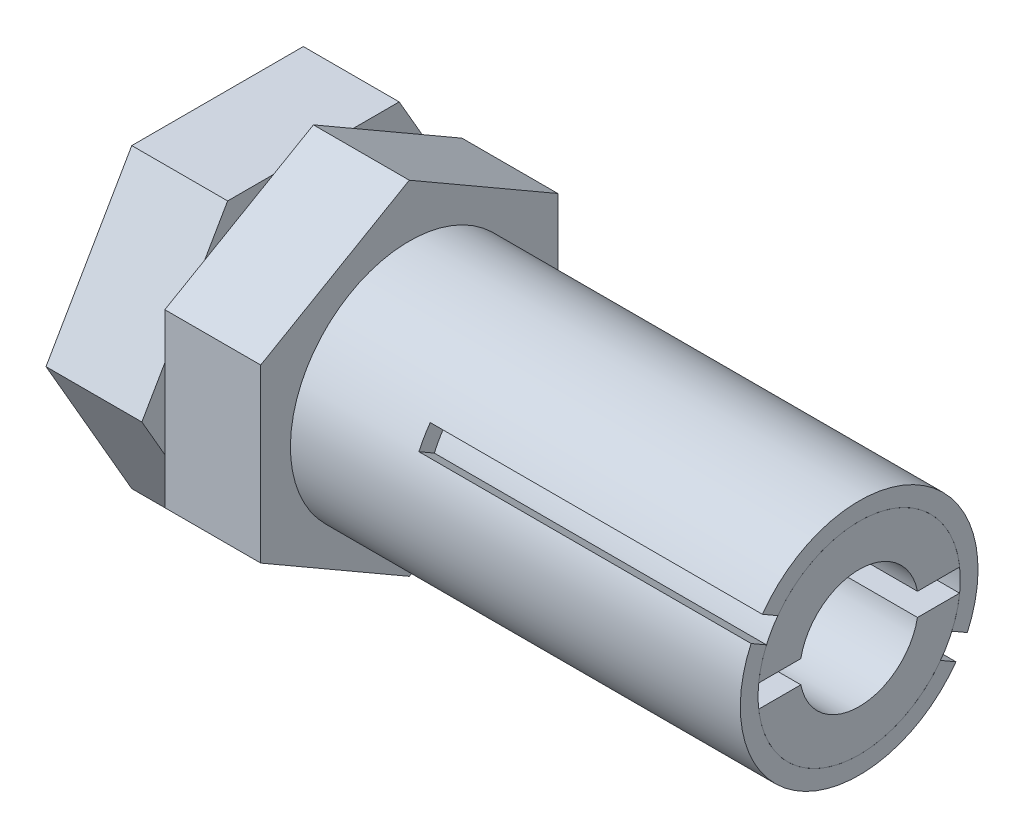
SolidWorks part; units mm, degrees
ref_plane "Front Plane" through (0, 0, 0) normal (0, 0, 1) x (1, 0, 0)
ref_plane "Top Plane" through (0, 0, 0) normal (0, 1, 0) x (1, 0, 0)
ref_plane "Right Plane" through (0, 0, 0) normal (1, 0, 0) x (0, 0, -1)
sketch "Sketch2" plane through (0, 0, 0) normal (1, 0, 0) x (0, 0, -1)
  line L1 (5.772, 0) -> (2.886, 4.9987)
  line L2 (2.886, 4.9987) -> (-2.886, 4.9987)
  line L3 (-2.886, 4.9987) -> (-5.772, 0)
  line L4 (-5.772, 0) -> (-2.886, -4.9987)
  line L5 (-2.886, -4.9987) -> (2.886, -4.9987)
  line L6 (2.886, -4.9987) -> (5.772, 0)
  circle A0 centre (0, 0) radius 4.9987 construction
  circle A1 centre (0, 0) radius 1.999
  dimension "D1" = 3.998
  dimension "D2" = 9.9974
extrude "Extrude1" add sketch "Sketch2" along normal blind 3.2258
sketch "Sketch3" plane through (3.2258, 0, 0) normal (1, 0, 0) x (0, 0, -1)
  line L1 (4.9987, 2.886) -> (0, 5.772)
  line L2 (0, 5.772) -> (-4.9987, 2.886)
  line L3 (-4.9987, 2.886) -> (-4.9987, -2.886)
  line L4 (-4.9987, -2.886) -> (0, -5.772)
  line L5 (0, -5.772) -> (4.9987, -2.886)
  line L6 (4.9987, -2.886) -> (4.9987, 2.886)
  circle A0 centre (0, 0) radius 4.9987 construction
  circle A1 centre (0, 0) radius 1.999
  dimension "D1" = 9.9974
  dimension "D2" = 3.998
extrude "Extrude2" add sketch "Sketch3" along normal blind 3.2258
sketch "Sketch4" plane through (6.4516, 0, 0) normal (1, 0, 0) x (0, 0, -1)
  circle A0 centre (0, 0) radius 1.999
  circle A1 centre (0, 0) radius 3.4036
  dimension "D1" = 6.8072
  dimension "D2" = 3.998
extrude "Extrude3" add sketch "Sketch4" along normal blind 15.1384
sketch "Sketch6" plane through (0, 0, 4.9987) normal (0, 0, 1) x (1, 0, 0)
  line L0 (21.59, -3.4036) -> (21.59, 3.4036) construction
  line L1 (10.414, 0.381) -> (23.7911, 0.381)
  line L2 (10.414, 0.381) -> (10.414, -0.381)
  line L3 (10.414, -0.381) -> (23.7911, -0.381)
  line L4 (23.7911, 0.381) -> (23.7911, -0.381)
  point P4 (23.7911, 0)
  dimension "D1" = 0.762
  dimension "D2" = 11.176
extrude "Cut-Extrude1" cut sketch "Sketch6" against normal through all
sketch "Sketch7" plane through (6.4516, 0, 0) normal (1, 0, 0) x (0, 0, -1)
  circle A0 centre (0, 0) radius 3.4036
  circle A1 centre (0, 0) radius 3.9992
  dimension "D1" = 7.9985
  dimension "D2" = 6.8072
extrude "Extrude4" add sketch "Sketch7" along normal blind 15.1384 separate body
sketch "Sketch8" plane through (0, 2.4994, 4.329) normal (0, 0.5, 0.866) x (1, 0, 0)
  line L0 (21.59, -3.9992) -> (21.59, 3.9992) construction
  line L1 (10.414, 0.381) -> (22.7401, 0.381)
  line L2 (10.414, 0.381) -> (10.414, -0.381)
  line L3 (10.414, -0.381) -> (22.7401, -0.381)
  line L4 (22.7401, 0.381) -> (22.7401, -0.381)
  point P6 (22.7401, 0)
  dimension "D1" = 0.762
  dimension "D2" = 11.176
extrude "Cut-Extrude2" cut sketch "Sketch8" against normal up to next
sketch "Sketch9" plane through (0, -2.4994, -4.329) normal (0, -0.5, -0.866) x (-1, 0, 0)
  line L0 (-21.59, 3.9992) -> (-21.59, -3.9992) construction
  line L1 (-22.0859, 0.381) -> (-10.414, 0.381)
  line L2 (-22.0859, 0.381) -> (-22.0859, -0.381)
  line L3 (-22.0859, -0.381) -> (-10.414, -0.381)
  line L4 (-10.414, 0.381) -> (-10.414, -0.381)
  point P4 (-22.0859, 0)
  dimension "D1" = 0.762
  dimension "D2" = 11.176
extrude "Cut-Extrude3" cut sketch "Sketch9" against normal up to next
